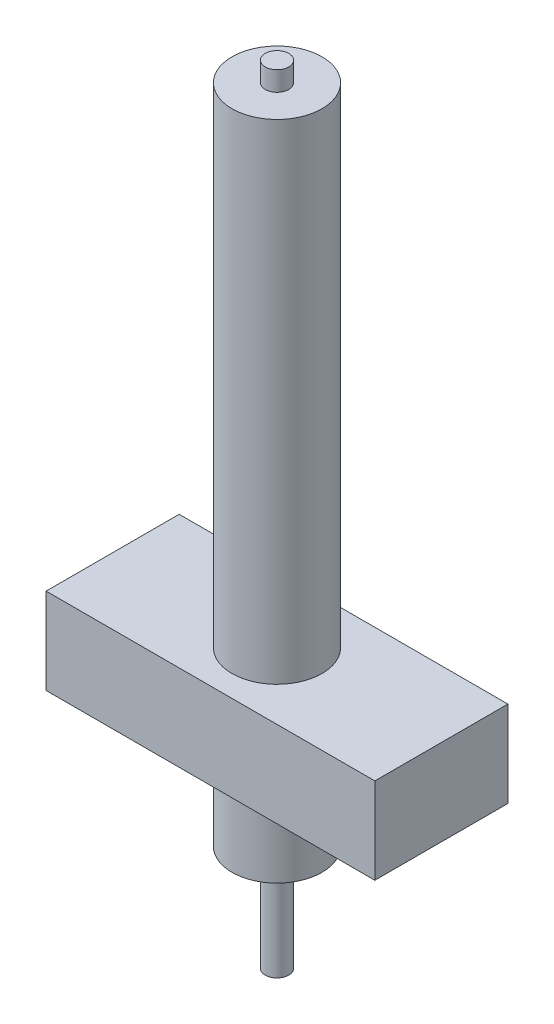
SolidWorks part; units mm, degrees
ref_plane "前视基准面" through (0, 0, 0) normal (0, 0, 1) x (1, 0, 0)
ref_plane "上视基准面" through (0, 0, 0) normal (0, 1, 0) x (1, 0, 0)
ref_plane "右视基准面" through (0, 0, 0) normal (1, 0, 0) x (0, 0, -1)
other "Configuration Table"
sketch "草图1" plane through (0, 0, 0) normal (0, 1, 0) x (1, 0, 0)
  circle A0 centre (0, 0) radius 5.75
extrude "凸台-拉伸1" add sketch "草图1" along normal blind 62.5
sketch "草图2" plane through (0, 62.5, 0) normal (0, 1, 0) x (1, 0, 0)
  circle A0 centre (0, 0) radius 1.5
extrude "凸台-拉伸2" add sketch "草图2" along normal blind 2.5
sketch "草图3" plane through (0, 0, 0) normal (0, -1, 0) x (1, 0, 0)
  line L1 (-21, -8.5) -> (21, -8.5)
  line L2 (-21, -8.5) -> (-21, 8.5)
  line L3 (-21, 8.5) -> (21, 8.5)
  line L4 (21, -8.5) -> (21, 8.5)
  line L5 (-21, -8.5) -> (21, 8.5) construction
  line L6 (-21, 8.5) -> (21, -8.5) construction
  point P0 (0, 0)
  dimension "D1" = 42
  dimension "D2" = 17
extrude "凸台-拉伸3" add sketch "草图3" along normal blind 11
sketch "草图5" plane through (0, -11, 0) normal (0, -1, 0) x (1, 0, 0)
  circle A0 centre (0, 0) radius 5.75
extrude "凸台-拉伸4" add sketch "草图5" along normal blind 11
sketch "草图6" plane through (0, -22, 0) normal (0, -1, 0) x (1, 0, 0)
  circle A0 centre (0, 0) radius 1.5
extrude "凸台-拉伸5" add sketch "草图6" along normal blind 13.5
